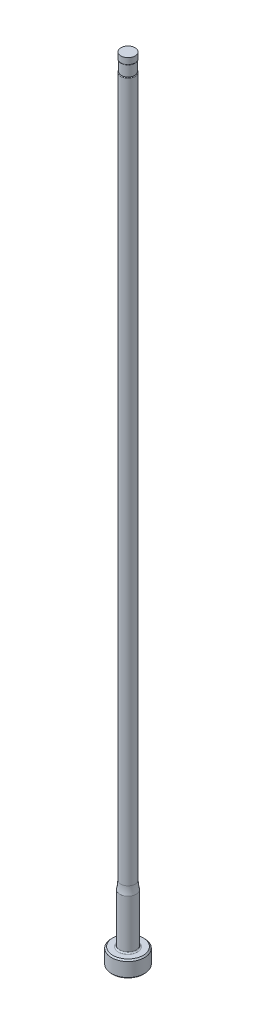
SolidWorks part; units mm, degrees
ref_plane "Front Plane" through (0, 0, 0) normal (0, 0, 1) x (1, 0, 0)
ref_plane "Top Plane" through (0, 0, 0) normal (0, 1, 0) x (1, 0, 0)
ref_plane "Right Plane" through (0, 0, 0) normal (1, 0, 0) x (0, 0, -1)
other "Configuration Table"
sketch "Sketch1" plane through (0, 0, 0) normal (0, 0, 1) x (1, 0, 0)
  line L0 (0, 259.9588) -> (0, -15.1925) construction
  line L1 (0, 0) -> (-3.175, 0)
  line L2 (-3.175, 0) -> (-3.175, 3.175)
  line L3 (-3.175, 3.175) -> (-1.5875, 3.175)
  line L4 (-1.3881, 14.2788) -> (-1.3881, 152.4)
  line L5 (-1.3881, 152.4) -> (0, 152.4)
  line L6 (0, 152.4) -> (0, 0)
  line L7 (-1.5875, 3.175) -> (-1.5875, 12.7)
  arc A1 (-1.5875, 12.7) -> (-1.3881, 14.2788) centre (-7.7381, 14.2788) ccw
  dimension "D1" = 6.35
  dimension "L" = 152.4
  dimension "D2" = 3.175
  dimension "H" = 6.35
  dimension "T" = 3.175
  dimension "D" = 2.7762
  dimension "S" = 12.7
revolve "Revolve1" add sketch "Sketch1" angle 360 about L0
chamfer "Chamfer1" distance 0.254 angle 45 2 edges at (0, 3.175, 3.175) (0, 0, 3.175)
fillet "Fillet1" radius 0.254 1 edges at (0, 3.175, 1.5875)
sketch "Sketch2" plane through (0, 0, 0) normal (0, 0, 1) x (1, 0, 0)
  line L0 (-1.3881, 152.4) -> (-1.3881, 14.2788) construction
  line L1 (-1.3881, 151.13) -> (-1.2865, 151.13)
  line L2 (-1.3881, 151.13) -> (-1.3881, 149.098)
  line L3 (-1.3881, 149.098) -> (-1.2865, 149.098)
  line L4 (-1.2865, 151.13) -> (-1.2865, 149.098)
  line L5 (1.3881, 152.4) -> (-1.3881, 152.4) construction
  line L6 (0, 153.4483) -> (0, 147.3282) construction
  dimension "D1" = 2.032
  dimension "N" = 1.27
  dimension "FD" = 0.1016
  dimension "D3" = 2.573
revolve "Vent Relief" cut sketch "Sketch2" angle 360 about L6
sketch "Sketch3" plane through (0, 0, 0) normal (0, 0, 1) x (1, 0, 0)
  line L0 (-1.2865, 150.114) -> (-1.2865, 112.014)
  line L1 (-1.2865, 151.13) -> (-1.2865, 149.098) construction
  line L2 (-1.3881, 149.098) -> (-1.3881, 14.2788) construction
  line L3 (-1.3881, 111.2172) -> (-1.3881, 150.114)
  line L4 (-1.3881, 150.114) -> (-1.2865, 150.114)
  arc A0 (-1.2865, 112.014) -> (-1.3881, 111.2172) centre (-4.4615, 112.014) cw
  dimension "D1" = 3.175
  dimension "D2" = 38.1
extrude "D-Slot" cut sketch "Sketch3" against normal through all both and the other way through all
sketch "Sketch5" plane through (0, 0, 0) normal (0, 0, 1) x (1, 0, 0)
  line L0 (-1.3881, 151.13) -> (1.3881, 151.13) construction
  line L1 (-1.3881, 152.4) -> (-1.3754, 152.4)
  line L2 (-1.3881, 152.4) -> (-1.3881, 151.13)
  line L3 (-1.3881, 151.13) -> (-1.3754, 151.13)
  line L4 (-1.3754, 152.4) -> (-1.3754, 151.13)
  line L5 (0, 152.6877) -> (0, 150.5771) construction
  dimension "VP" = 0.0127
revolve "Vent Diameter" cut sketch "Sketch5" angle 360 about L5
fillet "Fillet2" radius 0.127 2 edges at (1.3881, 149.098, 0) (0, 151.13, 1.3754)
sketch "Pocket Sketch" plane through (0, 0, 0) normal (0, 0, 1) x (1, 0, 0)
  line L0 (-3.5719, 0) -> (-3.5719, 3.2004)
  line L1 (-3.5719, 3.2004) -> (-2.3485, 3.2004)
  line L2 (-1.5865, 3.9624) -> (-1.5865, 22.225)
  line L3 (-1.5865, 22.225) -> (0, 22.225)
  line L4 (0, 22.225) -> (0, 0)
  line L5 (0, 0) -> (-3.5719, 0)
  line L6 (0, 12.6104) -> (0, -2.4989) construction
  line L7 (-3.175, 2.921) -> (-3.175, 0.254) construction
  line L8 (2.921, 3.175) -> (-2.921, 3.175) construction
  line L9 (-1.3881, 111.2172) -> (-1.3881, 14.2788) construction
  line L10 (-2.3485, 3.2004) -> (-1.5865, 3.9624)
  point P3 (-1.5865, 3.2004)
  dimension "D1" = 7.1437
  dimension "D2" = 0.3969
  dimension "D3" = 0.0254
  dimension "D4" = 0.1984
  dimension "D5" = 3.1731
  dimension "D6" = 22.225
